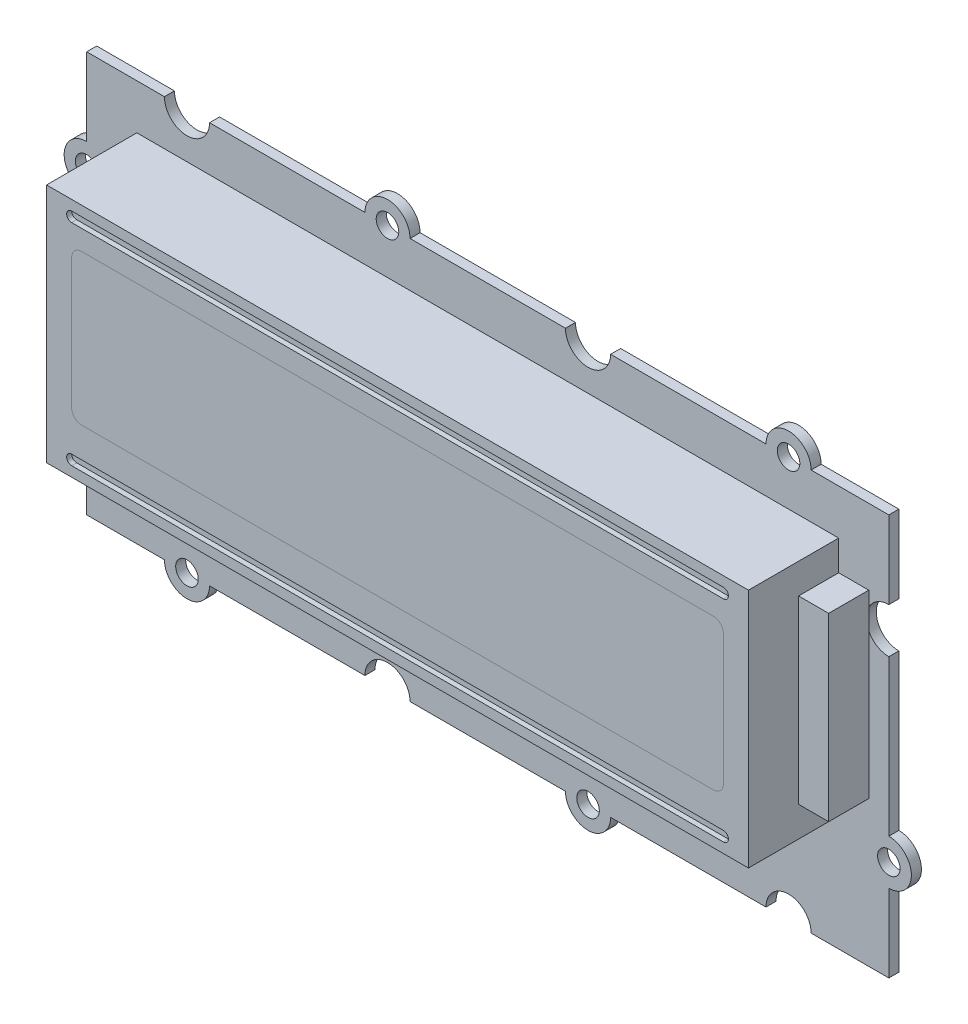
SolidWorks part; units mm, degrees
ref_plane "Plan de face" through (0, 0, 0) normal (0, 0, 1) x (1, 0, 0)
ref_plane "Plan de dessus" through (0, 0, 0) normal (0, 1, 0) x (1, 0, 0)
ref_plane "Plan de droite" through (0, 0, 0) normal (1, 0, 0) x (0, 0, -1)
sketch "Esquisse1" plane through (0, 0, 0) normal (0, 0, 1) x (1, 0, 0)
  line L0 (0, 30.9281) -> (0, -19.2371) construction
  line L1 (-46.5895, 0) -> (45.4509, 0) construction
  line L2 (-40, 20) -> (-32.25, 20)
  line L3 (-40, 20) -> (-40, 12.25)
  line L4 (-40, -20) -> (-32.25, -20)
  line L5 (40, 20) -> (40, 12.25)
  line L6 (30, 26.2841) -> (30, 14.2511) construction
  line L7 (10, 26.2841) -> (10, 14.2511) construction
  line L8 (-10, 26.2841) -> (-10, 14.2511) construction
  line L9 (-30, 26.2841) -> (-30, 14.2511) construction
  line L10 (32.3167, 10) -> (43.8027, 10) construction
  line L11 (-34.8317, 10) -> (-45.1683, 10) construction
  line L12 (-27.75, 20) -> (-12.25, 20)
  line L13 (-7.75, 20) -> (7.75, 20)
  line L14 (32.25, 20) -> (40, 20)
  line L15 (12.25, 20) -> (27.75, 20)
  line L16 (40, 7.75) -> (40, -7.75)
  line L17 (40, -12.25) -> (40, -20)
  line L18 (32.25, -20) -> (40, -20)
  line L19 (12.25, -20) -> (27.75, -20)
  line L20 (-7.75, -20) -> (7.75, -20)
  line L21 (-27.75, -20) -> (-12.25, -20)
  line L22 (-40, -12.25) -> (-40, -20)
  line L23 (-40, 7.75) -> (-40, -7.75)
  arc A0 (-40, 12.25) -> (-40, 7.75) centre (-40, 10) ccw
  arc A1 (-32.25, 20) -> (-27.75, 20) centre (-30, 20) ccw
  arc A2 (-7.75, 20) -> (-12.25, 20) centre (-10, 20) ccw
  arc A3 (7.75, 20) -> (12.25, 20) centre (10, 20) ccw
  arc A4 (32.25, 20) -> (27.75, 20) centre (30, 20) ccw
  arc A5 (40, 12.25) -> (40, 7.75) centre (40, 10) ccw
  circle A7 centre (-10, 20) radius 1.125
  circle A9 centre (30, 20) radius 1.125
  circle A11 centre (-40, 10) radius 1.125
  circle A12 centre (40, -10) radius 1.125
  arc A13 (40, -7.75) -> (40, -12.25) centre (40, -10) cw
  arc A15 (27.75, -20) -> (32.25, -20) centre (30, -20) cw
  circle A16 centre (10, -20) radius 1.125
  arc A17 (12.25, -20) -> (7.75, -20) centre (10, -20) cw
  arc A19 (-12.25, -20) -> (-7.75, -20) centre (-10, -20) cw
  circle A20 centre (-30, -20) radius 1.125
  arc A21 (-27.75, -20) -> (-32.25, -20) centre (-30, -20) cw
  arc A23 (-40, -7.75) -> (-40, -12.25) centre (-40, -10) cw
  dimension "D9" = 4.5
  dimension "D10" = 4.5
  dimension "D11" = 4.5
  dimension "D12" = 4.5
  dimension "D13" = 4.5
  dimension "D14" = 4.5
  dimension "D15" = 2.25
  dimension "D16" = 2.25
  dimension "D17" = 2.25
  dimension "D18" = 2.25
  dimension "D19" = 2.25
  dimension "D20" = 2.25
  dimension "D1" = 80
  dimension "D2" = 40
  dimension "D3" = 20
  dimension "D4" = 20
  dimension "D5" = 20
  dimension "D6" = 10
  dimension "D7" = 10
  dimension "D8" = 10
extrude "Boss.-Extru.1" add sketch "Esquisse1" along normal blind 1
sketch "Esquisse2" plane through (0, 0, 1) normal (0, 0, 1) x (1, 0, 0)
  line L0 (0, -23.7129) -> (0, 24.4015) construction
  line L1 (-35, 15.5) -> (35, 15.5)
  line L2 (-35, 15.5) -> (-35, -8.5)
  line L3 (-35, -8.5) -> (35, -8.5)
  line L4 (35, 15.5) -> (35, -8.5)
  line L5 (-31.5, 11.5) -> (31.5, 11.5)
  line L6 (-32.5, 10.5) -> (-32.5, -2.5)
  line L7 (-31.5, -3.5) -> (31.5, -3.5)
  line L8 (32.5, 10.5) -> (32.5, -2.5)
  line L9 (-32.25, 20) -> (-40, 20) construction
  arc A0 (31.5, -3.5) -> (32.5, -2.5) centre (31.5, -2.5) ccw
  arc A1 (31.5, 11.5) -> (32.5, 10.5) centre (31.5, 10.5) cw
  arc A2 (-32.5, -2.5) -> (-31.5, -3.5) centre (-31.5, -2.5) ccw
  arc A3 (-31.5, 11.5) -> (-32.5, 10.5) centre (-31.5, 10.5) ccw
  dimension "D7" = 1
  dimension "D1" = 70
  dimension "D2" = 24
  dimension "D3" = 4
  dimension "D4" = 15
  dimension "D5" = 65
  dimension "D6" = 4.5
extrude "Boss.-Extru.2" add sketch "Esquisse2" along normal blind 9
sketch "Esquisse3" plane through (0, 0, 10) normal (0, 0, 1) x (1, 0, 0)
  line L0 (0, -23.3686) -> (0, 26.295) construction
  line L2 (-32.5, 14.5) -> (32.5, 14.5)
  line L3 (-32.5, 13.2271) -> (-32.5, 14.6724) construction
  line L4 (-32.5, 13.5) -> (32.5, 13.5)
  line L5 (32.5, 13.1751) -> (32.5, 14.8249) construction
  line L6 (31.5, 11.5) -> (-31.5, 11.5) construction
  line L7 (-44.4775, 3.5) -> (44.11, 3.5) construction
  line L8 (35, 15.5) -> (-35, 15.5) construction
  line L9 (-35, -8.5) -> (35, -8.5) construction
  line L10 (32.5, -6.1751) -> (32.5, -7.8249) construction
  line L11 (-32.5, -6.2271) -> (-32.5, -7.6724) construction
  line L12 (-32.5, -6.5) -> (32.5, -6.5)
  line L13 (-32.5, -7.5) -> (32.5, -7.5)
  arc A0 (-32.5, 14.5) -> (-32.5, 13.5) centre (-32.5, 14) ccw
  arc A1 (32.5, 13.5) -> (32.5, 14.5) centre (32.5, 14) ccw
  arc A2 (32.5, -6.5) -> (32.5, -7.5) centre (32.5, -7) cw
  arc A3 (-32.5, -7.5) -> (-32.5, -6.5) centre (-32.5, -7) cw
  dimension "D1" = 65
  dimension "D2" = 1
  dimension "D3" = 2
extrude "Enlèv. mat.-Extru.1" cut sketch "Esquisse3" against normal blind 0.5
sketch "Esquisse4" plane through (0, 0, 10) normal (0, 0, 1) x (1, 0, 0)
  line L0 (32.5, -2.5) -> (32.5, 10.5) construction
  line L1 (-32.5, 10.5) -> (-32.5, -2.5) construction
  line L2 (-31.5, -3.5) -> (31.5, -3.5) construction
  line L3 (31.5, 11.5) -> (-31.5, 11.5) construction
  line L12 (32.5, -2.5) -> (32.5, 10.5)
  line L13 (-32.5, 10.5) -> (-32.5, -2.5)
  line L14 (-31.5, -3.5) -> (31.5, -3.5)
  line L15 (31.5, 11.5) -> (-31.5, 11.5)
  arc A0 (-31.5, 11.5) -> (-32.5, 10.5) centre (-31.5, 10.5) ccw construction
  arc A1 (-32.5, -2.5) -> (-31.5, -3.5) centre (-31.5, -2.5) ccw construction
  arc A2 (31.5, -3.5) -> (32.5, -2.5) centre (31.5, -2.5) ccw construction
  arc A3 (32.5, 10.5) -> (31.5, 11.5) centre (31.5, 10.5) ccw construction
  arc A4 (-31.5, 11.5) -> (-32.5, 10.5) centre (-31.5, 10.5) ccw
  arc A5 (-32.5, -2.5) -> (-31.5, -3.5) centre (-31.5, -2.5) ccw
  arc A6 (31.5, -3.5) -> (32.5, -2.5) centre (31.5, -2.5) ccw
  arc A7 (32.5, 10.5) -> (31.5, 11.5) centre (31.5, 10.5) ccw
extrude "Boss.-Extru.4" add sketch "Esquisse4" against normal blind 1 separate body
sketch "Esquisse5" plane through (35, 0, 0) normal (1, 0, 0) x (0, 0, -1)
  line L1 (-1, -8.5) -> (-1, 15.5) construction
  line L2 (-1, 12.5) -> (-5, 12.5)
  line L3 (-1, 12.5) -> (-1, -5.5)
  line L4 (-1, -5.5) -> (-5, -5.5)
  line L7 (-5, 12.5) -> (-5, -5.5)
  line L8 (5.1616, 3.5) -> (-17.1184, 3.5) construction
  line L9 (-10, 15.5) -> (-1, 15.5) construction
  line L10 (-10, -8.5) -> (-1, -8.5) construction
  point P6 (-3, 12.5)
  dimension "D1" = 18
  dimension "D2" = 4
extrude "Boss.-Extru.5" add sketch "Esquisse5" along normal blind 3
